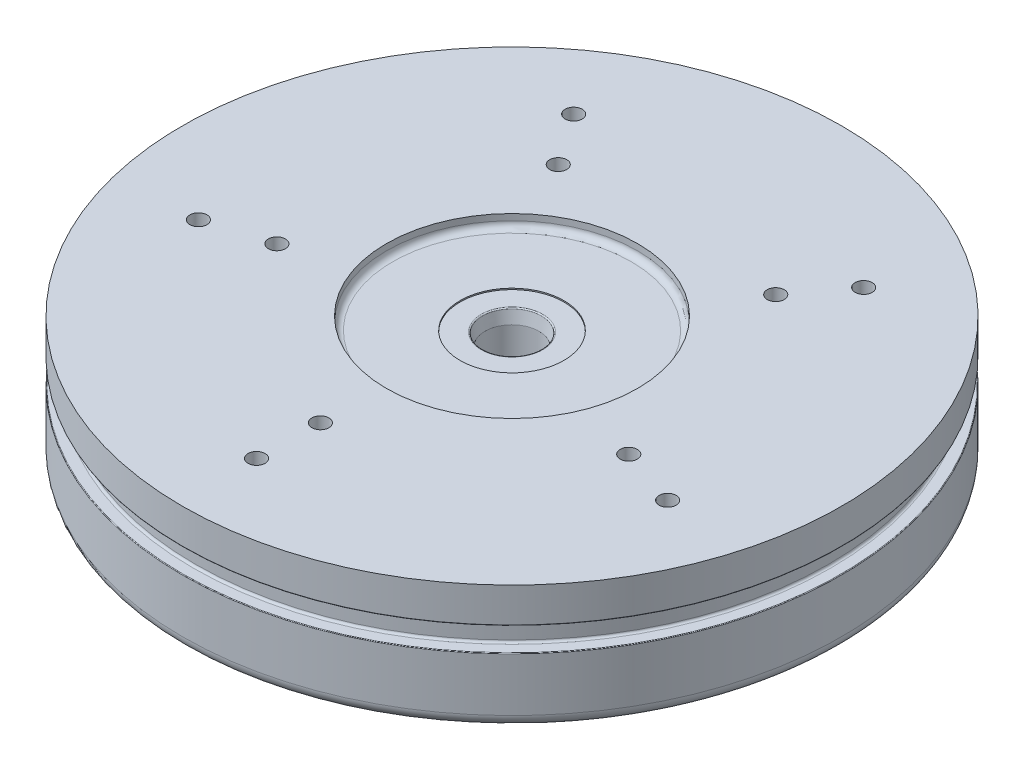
SolidWorks part; units mm, degrees
ref_plane "Front Plane" through (0, 0, 0) normal (0, 0, 1) x (1, 0, 0)
ref_plane "Top Plane" through (0, 0, 0) normal (0, 1, 0) x (1, 0, 0)
ref_plane "Right Plane" through (0, 0, 0) normal (1, 0, 0) x (0, 0, -1)
sketch "Sketch1" plane through (0, 0, 0) normal (0, 0, 1) x (1, 0, 0)
  line L0 (0, 12.7) -> (0, 47.6475) construction
  line L1 (-64.4779, 13.462) -> (-66.548, 13.462)
  line L2 (-64.0334, 13.9065) -> (-64.0334, 17.8435)
  line L3 (0, 12.7) -> (0, 25.4)
  line L4 (0, 12.7) -> (-53.975, 0)
  line L5 (-64.4779, 18.288) -> (-66.548, 18.288)
  line L6 (-66.675, 13.335) -> (-66.675, 0)
  line L7 (-66.675, 0) -> (-53.975, 0)
  line L8 (-66.675, 18.415) -> (-66.675, 25.4)
  line L11 (-66.675, 25.4) -> (0, 25.4)
  arc A0 (-66.548, 13.462) -> (-66.675, 13.335) centre (-66.548, 13.335) ccw
  arc A1 (-66.548, 18.288) -> (-66.675, 18.415) centre (-66.548, 18.415) cw
  arc A2 (-64.0334, 17.8435) -> (-64.4779, 18.288) centre (-64.4779, 17.8435) ccw
  arc A3 (-64.4779, 13.462) -> (-64.0334, 13.9065) centre (-64.4779, 13.9065) ccw
  point P0 (-64.0334, 15.875)
  dimension "D6" = 0.127
  dimension "D7" = 0.4445
  dimension "D1" = 25.4
  dimension "D2" = 2.6416
  dimension "D3" = 4.826
  dimension "D4" = 133.35
  dimension "D5" = 9.525
  dimension "D8" = 12.7
revolve "Revolve1" add sketch "Sketch1" angle 360 about L0
fillet "Fillet1" radius 2.54 1 edges at (0, 0, -66.675)
hole_wizard "#8-32 Tapped Hole1" positions "Sketch4" profile "Sketch3" tap size "#8-32" standard "ANSI Inch"
sketch "Sketch4" plane through (0, 25.4, 0) normal (0, 1, 0) x (1, 0, 0)
  point P0 (36.0243, -12.4041)
  point P3 (48.0323, -16.5389)
sketch "Sketch3" plane through (36.0243, 25.4, 12.4041) normal (1, 0, 0) x (0, 0, 1)
  line L0 (0, 0) -> (0, 9.7754)
  line L1 (0, 9.7754) -> (1.7272, 8.7376)
  line L2 (1.7272, 8.7376) -> (1.7272, 0)
  line L5 (1.7272, 0) -> (0, 0)
  line L10 (0, 9.7754) -> (-1.7272, 8.7376) construction
  line L11 (0, -6.35) -> (0, 107.95) construction
  dimension "Tap Drill Dia." = 3.4544
  dimension "Tap Drill Depth" = 8.7376
  dimension "Drill Angle" = 118
pattern_circular "CirPattern1" count 5 over 360 about axis through (0, 0, 0) along (0, 1, 0) of "#8-32 Tapped Hole1"
sketch "Sketch5" plane through (0, 25.4, 0) normal (0, 1, 0) x (1, 0, 0)
  circle A0 centre (0, 0) radius 25.4
  dimension "D1" = 50.8
extrude "Cut-Extrude1" cut sketch "Sketch5" against normal blind 2.54
fillet "Fillet2" radius 1.27 1 edges at (0, 22.86, 25.4)
sketch "Sketch2" plane through (14.3545, 22.86, -15.3739) normal (0, -1, 0) x (1, 0, 0)
  line L0 (-11.9352, 13.3178) -> (-16.7739, 17.4299) construction
  line L1 (-16.4106, 12.9545) -> (-12.2985, 17.7932) construction
  circle A0 centre (-14.3545, 15.3739) radius 24.13 construction
  point P5 (-14.3545, 15.3739)
  point P8 (-14.3545, 15.3739)
  dimension "D3" = 6.35
ref_plane "Plane1" through (0, 22.86, 0) normal (-0.762, 0, 0.6476) x (0.6476, 0, 0.762)
sketch "Port Sketch" plane through (-1.2353, 22.86, -1.4536) normal (0.762, 0, -0.6476) x (0.6476, 0, 0.762)
  line L0 (1.9075, 0) -> (1.9075, 45.0293) construction
  line L1 (1.9075, 28.6346) -> (6.8682, 25.654)
  line L2 (6.8682, 25.654) -> (6.8682, 11.754)
  line L3 (6.8682, 11.754) -> (7.4638, 11.754)
  line L4 (7.4638, 11.754) -> (7.4638, 2.7644)
  line L5 (7.4638, 2.7644) -> (7.3742, 2.854)
  line L6 (7.3742, 2.854) -> (7.8841, 0.4552)
  line L7 (8.1325, 0.254) -> (12.4075, 0.254)
  line L8 (12.4075, 0.254) -> (12.4075, 0)
  line L10 (12.4075, 0) -> (1.9075, 0)
  line L11 (1.9075, 0) -> (1.9075, 28.6346)
  line L12 (-3.5591, 2.854) -> (-4.069, 0.4552) construction
  line L13 (-3.6487, 2.7644) -> (-3.5591, 2.854) construction
  line L14 (1.9075, 28.6346) -> (-3.0531, 25.654) construction
  arc A0 (7.8841, 0.4552) -> (8.1325, 0.254) centre (8.1325, 0.508) ccw
  dimension "D1" = 0.254
  dimension "Countersink angle" = 118
  dimension "D3" = 45
  dimension "TapDrillDia" = 9.9212
  dimension "D5" = 12.45
  dimension "ThdMjr" = 11.1125
  dimension "SpotDia" = 21
  dimension "L3" = 0.254
  dimension "L1" = 2.6
  dimension "ThdDp" = 11.5
  dimension "TapDrillDp" = 25.4
  dimension "K" = 12
revolve "SAE Port" cut sketch "Port Sketch" angle 360 about L0
other "sae j1926-1 (circular face)<1>"
